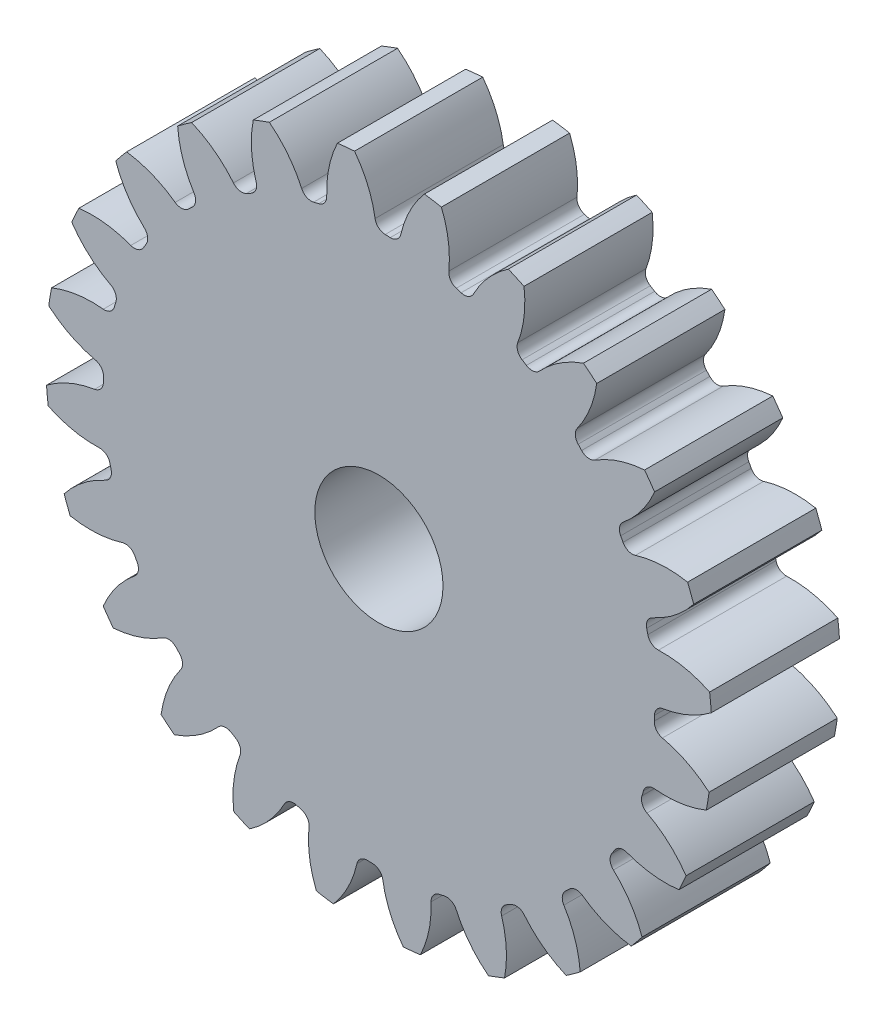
SolidWorks part; units mm, degrees
ref_plane "Front" through (0, 0, 0) normal (0, 0, 1) x (1, 0, 0)
ref_plane "Top" through (0, 0, 0) normal (0, 1, 0) x (1, 0, 0)
ref_plane "Right" through (0, 0, 0) normal (1, 0, 0) x (0, 0, -1)
sketch "Sketch3" plane through (0, 0, 0) normal (0, 0, 1) x (1, 0, 0)
  circle A0 centre (0, 0) radius 264.16
  dimension "od" = 528.32
extrude "gearBody" add sketch "Sketch3" along normal blind 101.6
sketch "Sketch2" plane through (0, 0, 0) normal (0, 0, 1) x (1, 0, 0)
  line L0 (0, 0) -> (211.6928, 87.686) construction
  line L1 (262.3544, -36.6689) -> (0, 0) construction
  line L2 (0, 0) -> (36.3143, 0) construction
  line L3 (243.7046, 8.1238) -> (242.6891, -23.6636) construction
  line L5 (243.1968, -7.7699) -> (0, 0) construction
  line L7 (0, 0) -> (229.1346, 0) construction
  arc A0 (229.1046, 3.7115) -> (228.4004, -18.3283) centre (0, 0) ccw construction
  arc A1 (263.4535, 19.3067) -> (261.6838, -36.0844) centre (0, 0) ccw construction
  arc A2 (243.7046, 8.1238) -> (242.6891, -23.6636) centre (0, 0) ccw construction
  arc A3 (218.2549, -8.9905) -> (218.3837, -4.9596) centre (0, 0) ccw
  arc A4 (262.3544, -36.6689) -> (224.684, -17.3952) centre (205.6638, -101.0202) ccw
  arc A5 (262.3544, -36.6689) -> (264.16, 19.8473) centre (0, 0) ccw
  arc A6 (264.16, 19.8473) -> (225.3361, 3.0175) centre (211.6928, 87.686) cw
  arc A7 (218.3837, -4.9596) -> (225.3361, 3.0175) centre (226.6518, -5.1474) cw
  arc A8 (224.684, -17.3952) -> (218.2549, -8.9905) centre (226.5181, -9.3309) cw
  point P6 (264.16, 19.8473)
  point P22 (262.3544, -36.6689)
  dimension "baseDia" = 458.2693
  dimension "od" = 528.32
  dimension "pd" = 487.68
  dimension "rd" = 436.88
  dimension "rFillet" = 8.2702
  dimension "pointX" = 264.16
  dimension "pointY" = 19.8473
  dimension "CTT" = 31.7875
  dimension "flankCenterAngle" = 22.5
extrude "toothCut" cut sketch "Sketch2" along normal through all
pattern_circular "CirPattern1" count 24 over 360 about axis through (0, 0, 0) along (0, 0, 1) of "toothCut"
sketch "hub1Dia" plane through (0, 0, 0) normal (0, 0, -1) x (-1, 0, 0)
  circle A0 centre (0, 0) radius 12.7
  dimension "hub1Dia" = 25.4
sketch "hub2Dia" plane through (0, 0, 101.6) normal (0, 0, 1) x (1, 0, 0)
  circle A0 centre (0, 0) radius 12.7
  dimension "hub2dia" = 25.4
sketch "boreDia" plane through (0, 0, 0) normal (0, 0, 1) x (1, 0, 0)
  circle A0 centre (0, 0) radius 50.8
  dimension "boreDia" = 101.6
extrude "bore" cut sketch "boreDia" against normal mid plane 25400
